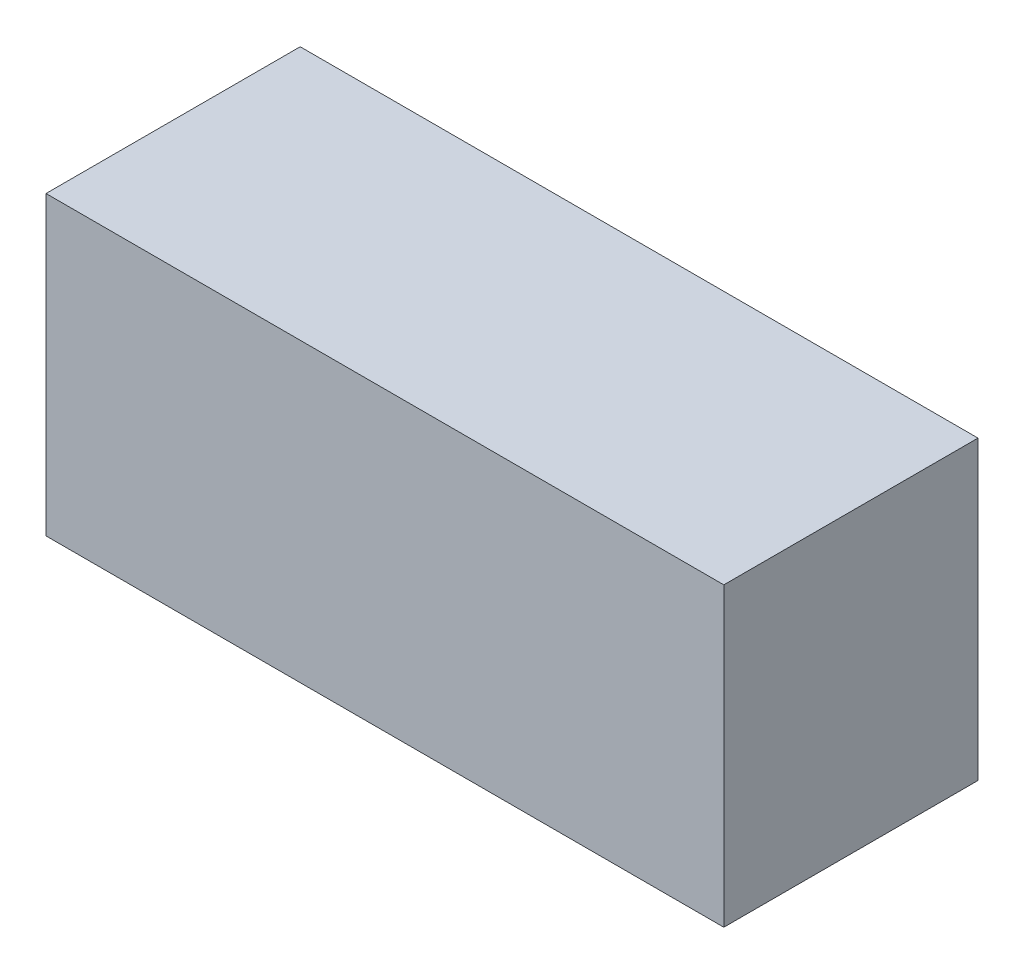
SolidWorks part; units mm, degrees
ref_plane "Plan de face" through (0, 0, 0) normal (0, 0, 1) x (1, 0, 0)
ref_plane "Plan de dessus" through (0, 0, 0) normal (0, 1, 0) x (1, 0, 0)
ref_plane "Plan de droite" through (0, 0, 0) normal (1, 0, 0) x (0, 0, -1)
sketch "Esquisse1" plane through (0, 0, 0) normal (0, 0, 1) x (1, 0, 0)
  line L1 (0, 0) -> (80, 0)
  line L2 (0, 0) -> (0, 35)
  line L3 (0, 35) -> (80, 35)
  line L4 (80, 0) -> (80, 35)
  dimension "D1" = 80
  dimension "D2" = 35
extrude "Boss.-Extru.1" add sketch "Esquisse1" along normal mid plane 30
